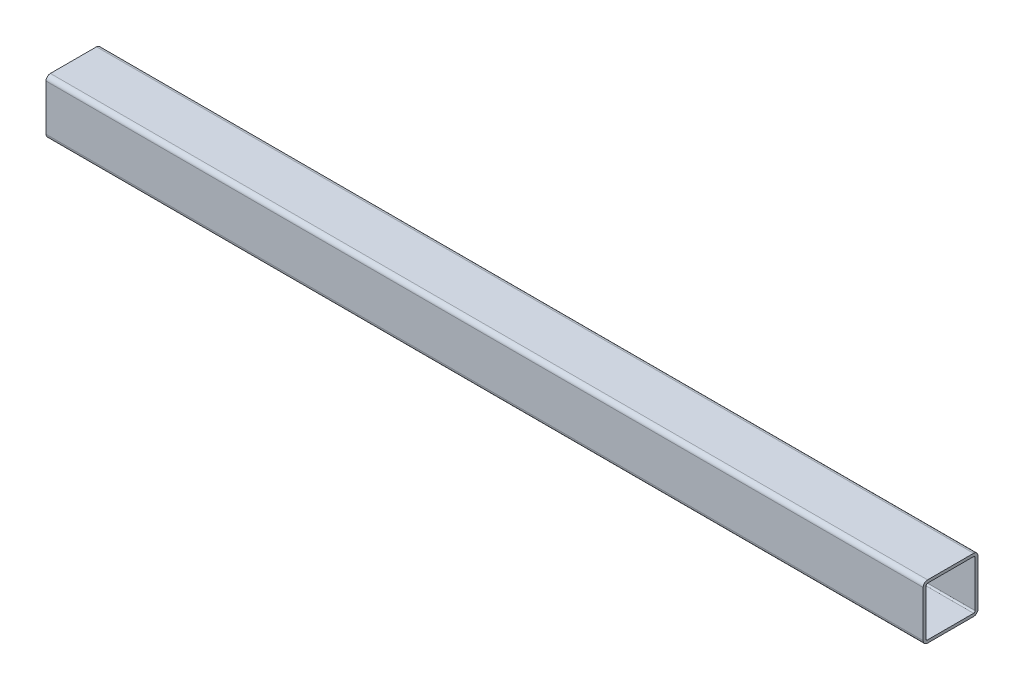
SolidWorks part; units mm, degrees
ref_plane "Front Plane" through (0, 0, 0) normal (0, 0, 1) x (1, 0, 0)
ref_plane "Top Plane" through (0, 0, 0) normal (0, 1, 0) x (1, 0, 0)
ref_plane "Right Plane" through (0, 0, 0) normal (1, 0, 0) x (0, 0, -1)
sketch "Sketch1" plane through (0, 0, 0) normal (1, 0, 0) x (0, 0, -1)
  line L0 (0, 2.54) -> (0, 29.21)
  line L1 (-2.54, 31.75) -> (-29.21, 31.75)
  line L2 (-31.75, 29.21) -> (-31.75, 2.54)
  line L3 (-29.21, 0) -> (-2.54, 0)
  line L4 (-1.651, 2.54) -> (-1.651, 29.21)
  line L5 (-2.54, 30.099) -> (-29.21, 30.099)
  line L6 (-30.099, 29.21) -> (-30.099, 2.54)
  line L7 (-29.21, 1.651) -> (-2.54, 1.651)
  arc A0 (-31.75, 2.54) -> (-29.21, 0) centre (-29.21, 2.54) ccw
  arc A1 (0, 2.54) -> (-2.54, 0) centre (-2.54, 2.54) cw
  arc A2 (0, 29.21) -> (-2.54, 31.75) centre (-2.54, 29.21) ccw
  arc A3 (-31.75, 29.21) -> (-29.21, 31.75) centre (-29.21, 29.21) cw
  arc A4 (-1.651, 29.21) -> (-2.54, 30.099) centre (-2.54, 29.21) ccw
  arc A5 (-30.099, 29.21) -> (-29.21, 30.099) centre (-29.21, 29.21) cw
  arc A6 (-30.099, 2.54) -> (-29.21, 1.651) centre (-29.21, 2.54) ccw
  arc A7 (-1.651, 2.54) -> (-2.54, 1.651) centre (-2.54, 2.54) cw
  point P12 (0, 0)
  point P15 (0, 31.75)
  point P18 (-31.75, 31.75)
  dimension "D3" = 2.54
  dimension "D1" = 31.75
  dimension "D2" = 31.75
  dimension "D4" = 1.651
extrude "Boss-Extrude1" add sketch "Sketch1" along normal blind 203.2
scale "Scale1" scale about centroid uniform scaling no x scale factor 1 y scale factor 0.4 z scale factor 0.4
